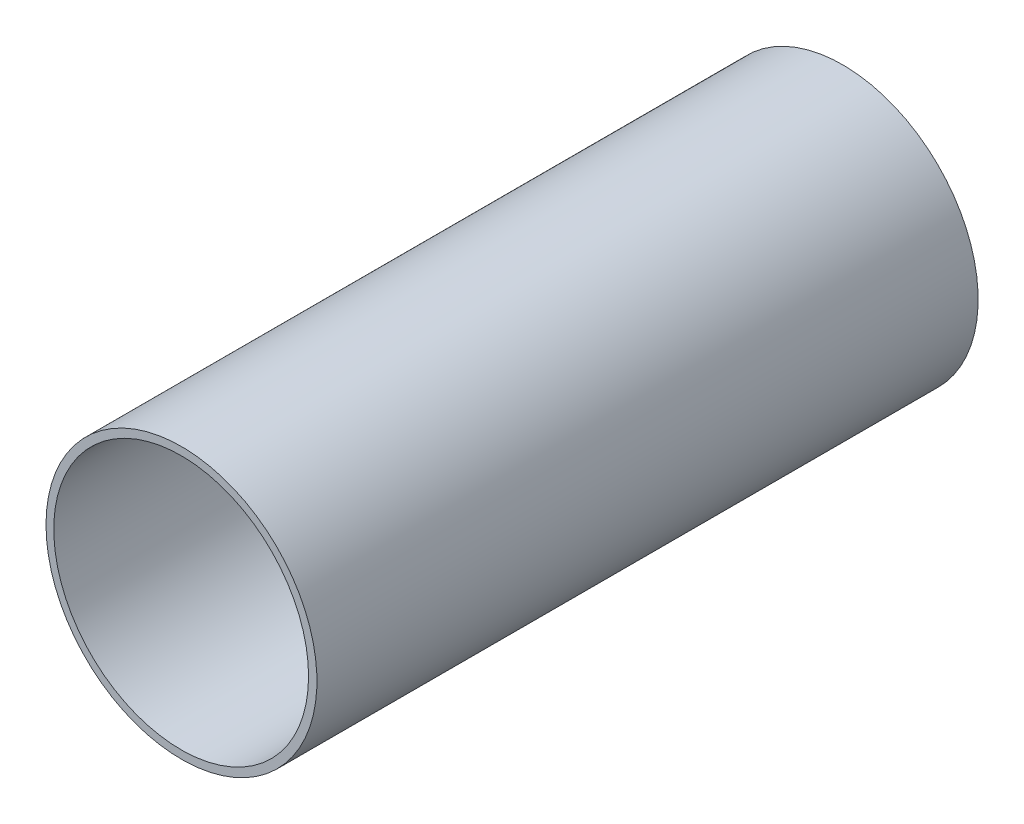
SolidWorks part; units mm, degrees
ref_plane "Plan de face" through (0, 0, 0) normal (0, 0, 1) x (1, 0, 0)
ref_plane "Plan de dessus" through (0, 0, 0) normal (0, 1, 0) x (1, 0, 0)
ref_plane "Plan de droite" through (0, 0, 0) normal (1, 0, 0) x (0, 0, -1)
sketch "Esquisse1" plane through (0, 0, 0) normal (0, 0, 1) x (1, 0, 0)
  circle A0 centre (-13.7053, 0) radius 42
extrude "Boss.-Extru.5" add sketch "Esquisse1" along normal blind 205
sketch "Esquisse6" plane through (0, 0, 205) normal (0, 0, 1) x (1, 0, 0)
  circle A0 centre (-13.8008, 0) radius 39.5
extrude "Enlèv. mat.-Extru.2" cut sketch "Esquisse6" against normal through all both and the other way through all
sketch3d "Esquisse3D1"
  line L0 (0, -1.297, -17.4208) -> (0, -1.297, -78.8991) construction
  line L2 (0, 40.4086, -53.6698) -> (0, 38.0663, -53.6698)
  line L3 (0, 7.2017, -86.2228) -> (0, 9.7017, -86.2228)
  line L4 (0, 40.4086, -53.6698) -> (0, 9.7017, -86.2228)
  line L5 (0, 40.4086, -53.6698) -> (0, 37.9086, -53.6698)
  line L6 (0, 9.7017, -86.2228) -> (0, 7.2017, -86.2228)
  line L7 (0, 37.9086, -53.6698) -> (0, 7.2017, -86.2228)
  line L8 (0, 9.7017, -86.2228) -> (0, 9.7017, -101.2228)
  line L10 (0, 7.2017, -86.2228) -> (0, 9.7017, -86.2228)
  line L11 (0, 7.2017, -86.2228) -> (0, 7.2017, -101.2228)
  line L12 (0, 7.2017, -101.2228) -> (0, 9.7017, -101.2228)
  line L13 (0, 9.7017, -86.2228) -> (0, 9.7017, -101.2228)
sketch "Esquisse7" plane through (0, 0, 205) normal (0, 0, 1) x (1, 0, 0)
sketch "Esquisse8" plane through (-134.48, -0.2898, 205) normal (0, 0, 1) x (1, 0, 0)
  circle A0 centre (120.4849, 0) radius 42
extrude "Boss.-Extru.9" add sketch "Esquisse8" along normal blind 2 separate body contours A0
sketch "Esquisse11" plane through (0, 0, 0) normal (1, 0, 0) x (0, 0, -1)
  line L0 (11.4199, -17.6733) -> (11.4199, -20.1733)
  line L1 (61.4199, 13.3267) -> (61.4199, 10.8267)
  line L2 (61.4199, 10.8267) -> (76.2856, 10.8267)
  line L3 (11.4199, -17.6733) -> (61.4199, 13.3267)
  line L4 (11.4199, -20.1733) -> (61.4199, 10.8267)
  line L5 (76.2856, 10.8267) -> (76.2856, 13.3267)
  line L6 (76.2856, 13.3267) -> (61.4199, 13.3267)
  line L7 (11.4199, -20.1733) -> (11.4199, 21.8267) construction
  line L8 (61.4199, 13.3267) -> (76.2856, 13.3267)
  line L9 (61.4199, 13.3267) -> (61.4199, 10.8267)
  line L10 (61.4199, 10.8267) -> (76.2856, 10.8267)
  line L11 (76.2856, 13.3267) -> (76.2856, 10.8267)
  line L12 (11.4199, 21.8267) -> (50011.4199, 21.8267) construction
  line L13 (76.2856, 21.8267) -> (76.2856, 15.8267) construction
